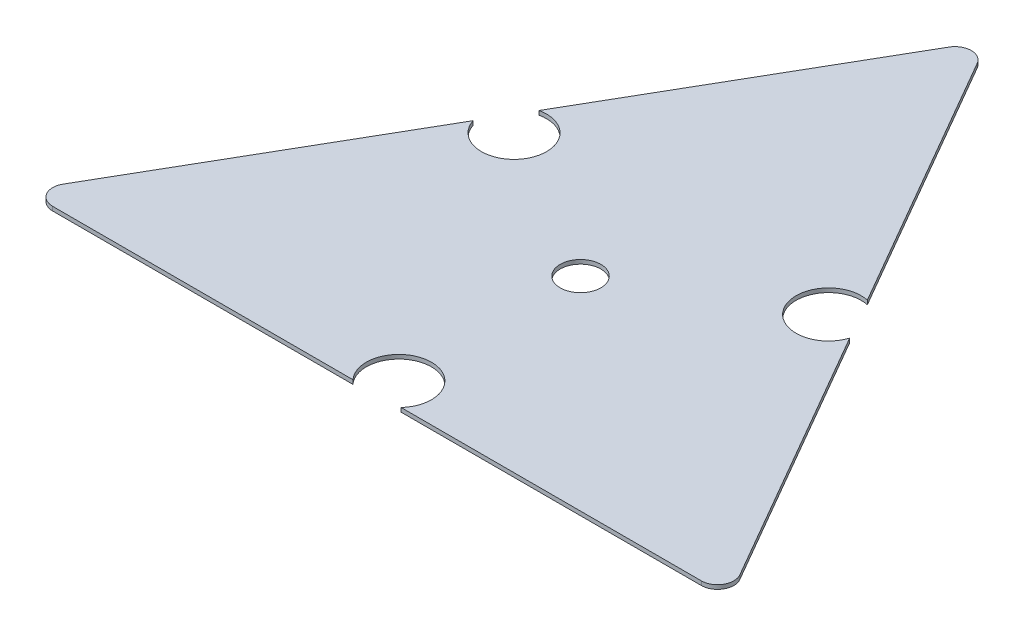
SolidWorks part; units mm, degrees
ref_plane "Plan de face" through (0, 0, 0) normal (0, 0, 1) x (1, 0, 0)
ref_plane "Plan de dessus" through (0, 0, 0) normal (0, 1, 0) x (1, 0, 0)
ref_plane "Plan de droite" through (0, 0, 0) normal (1, 0, 0) x (0, 0, -1)
sketch "Esquisse1" plane through (0, 0, 0) normal (0, 1, 0) x (1, 0, 0)
  line L0 (-39.2989, 50) -> (59.2636, 50) construction
  line L1 (0, -5.9019) -> (0, -16.443) construction
  line L2 (43.3013, -25) -> (0, 0) construction
  line L3 (0, 50) -> (-20.1689, 15.0664)
  line L4 (-43.3013, -25) -> (-2.9634, -25)
  line L5 (0, 50) -> (20.1689, 15.0664)
  line L6 (0, 0) -> (68.357, 39.4659) construction
  line L7 (0, 0) -> (-63.4066, 36.6078) construction
  line L8 (-43.3013, -14.5081) -> (-43.3013, -36.1962) construction
  line L9 (-57.4914, -25.3522) -> (-36.6562, -25) construction
  line L10 (0, 0) -> (-43.3013, -25) construction
  line L11 (23.1323, 9.9336) -> (43.3013, -25)
  line L12 (-23.1323, 9.9336) -> (-43.3013, -25)
  line L13 (2.9634, -25) -> (43.3013, -25)
  circle A0 centre (0, 0) radius 50 construction
  circle A1 centre (0, 0) radius 2.5
  circle A2 centre (-18.1865, 10.5) radius 2.5 construction
  circle A3 centre (0, -21) radius 2.5 construction
  circle A4 centre (18.1865, 10.5) radius 2.5 construction
  arc A5 (-23.1323, 9.9336) -> (-20.1689, 15.0664) centre (-19.3239, 11.1566) ccw
  arc A6 (-2.9634, -25) -> (2.9634, -25) centre (0, -22.3133) cw
  arc A7 (20.1689, 15.0664) -> (23.1323, 9.9336) centre (19.3239, 11.1566) ccw
  point P12 (0, -25)
extrude "Extrusion1" add sketch "Esquisse1" against normal blind 0.5
fillet "Congé1" radius 2 3 edges at (-43.3013, -0.25, 25) (0, -0.25, -50) (43.3013, -0.25, 25)
